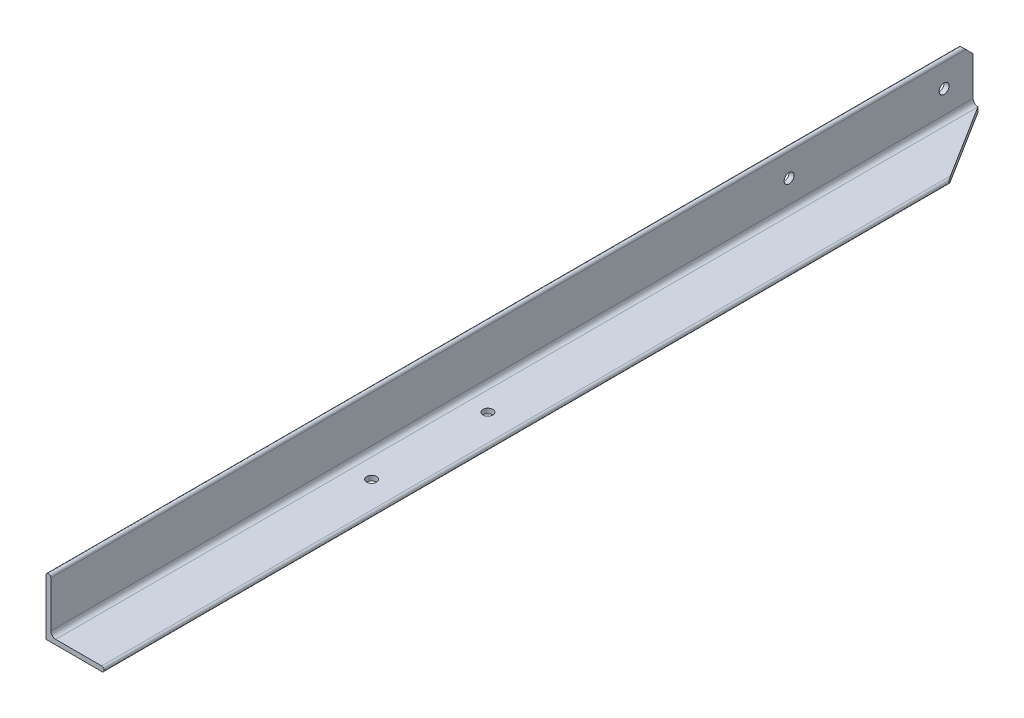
SolidWorks part; units mm, degrees
ref_plane "Front" through (0, 0, 0) normal (0, 0, 1) x (1, 0, 0)
ref_plane "Top" through (0, 0, 0) normal (0, 1, 0) x (1, 0, 0)
ref_plane "Right" through (0, 0, 0) normal (1, 0, 0) x (0, 0, -1)
sketch "Sketch1" plane through (0, 0, 0) normal (0, 0, 1) x (1, 0, 0)
  line L0 (0, 0) -> (0, 36.5125)
  line L1 (0, 0) -> (36.5125, 0)
  line L2 (6.35, 3.175) -> (36.5125, 3.175)
  line L3 (3.175, 6.35) -> (3.175, 36.5125)
  line L4 (3.175, 3.175) -> (3.175, 38.1) construction
  line L5 (3.175, 3.175) -> (38.1, 3.175) construction
  line L6 (0, 38.1) -> (3.175, 38.1) construction
  line L7 (38.1, 3.175) -> (38.1, 0) construction
  line L9 (0, 0) -> (38.1, 0) construction
  line L10 (0, 0) -> (0, 38.1) construction
  arc A0 (3.175, 6.35) -> (6.35, 3.175) centre (6.35, 6.35) ccw
  arc A1 (3.175, 36.5125) -> (0, 36.5125) centre (1.5875, 36.5125) ccw
  arc A2 (36.5125, 0) -> (36.5125, 3.175) centre (36.5125, 1.5875) ccw
  dimension "D4" = 3.175
  dimension "D1" = 38.1
  dimension "D2" = 38.1
  dimension "D3" = 3.175
extrude "Boss-Extrude1" add sketch "Sketch1" along normal mid plane 604.4921
sketch "Sketch5" plane through (3.175, 0, 0) normal (1, 0, 0) x (0, 0, -1)
  line L0 (302.246, 38.1) -> (302.246, 31.75)
  line L1 (302.246, 6.35) -> (302.246, 36.5125) construction
  line L2 (302.246, 31.75) -> (295.896, 38.1)
  line L3 (302.246, 38.1) -> (-302.246, 38.1) construction
  line L4 (295.896, 38.1) -> (302.246, 38.1)
  line L5 (302.246, 38.1) -> (-302.246, 38.1) construction
  circle A0 centre (283.196, 21.4313) radius 3.2385
  circle A1 centre (181.596, 21.4312) radius 3.2385
  point P10 (0, 0)
  point P13 (0, 0)
  point P14 (0, 0)
  dimension "D3" = 6.477
  dimension "D7" = 16.6687
  dimension "D1" = 6.35
  dimension "D2" = 6.35
  dimension "D4" = 19.05
  dimension "D6" = 101.6
  dimension "D5" = 2
extrude "Cut-Extrude3" cut sketch "Sketch5" against normal through all
sketch "Sketch6" plane through (0, 3.175, 0) normal (0, 1, 0) x (1, 0, 0)
  line L0 (38.1, 302.246) -> (6.35, 302.246)
  line L1 (36.5125, 302.246) -> (6.35, 302.246) construction
  line L2 (6.35, 302.246) -> (38.1, 251.446)
  line L3 (38.1, -302.246) -> (38.1, 302.246) construction
  line L4 (38.1, 251.446) -> (38.1, 302.246)
  dimension "D1" = 31.75
  dimension "D2" = 50.8
extrude "Cut-Extrude4" cut sketch "Sketch6" against normal through all
sketch "Sketch7" plane through (0, 0, 0) normal (0, -1, 0) x (1, 0, 0)
  line L2 (0, 302.246) -> (0, -302.246) construction
  line L3 (0, -302.246) -> (6.35, -302.246) construction
  circle A0 centre (19.05, 31.6885) radius 3.2385
  circle A1 centre (19.05, 107.8885) radius 3.2385
  point P6 (0, 0)
  point P7 (0, 0)
  point P10 (0, 0)
  point P13 (3.175, -302.246)
  dimension "D1" = 6.477
  dimension "D2" = 76.2
  dimension "D3" = 19.05
  dimension "D4" = 333.9346
extrude "Cut-Extrude5" cut sketch "Sketch7" against normal through all both and the other way through all
